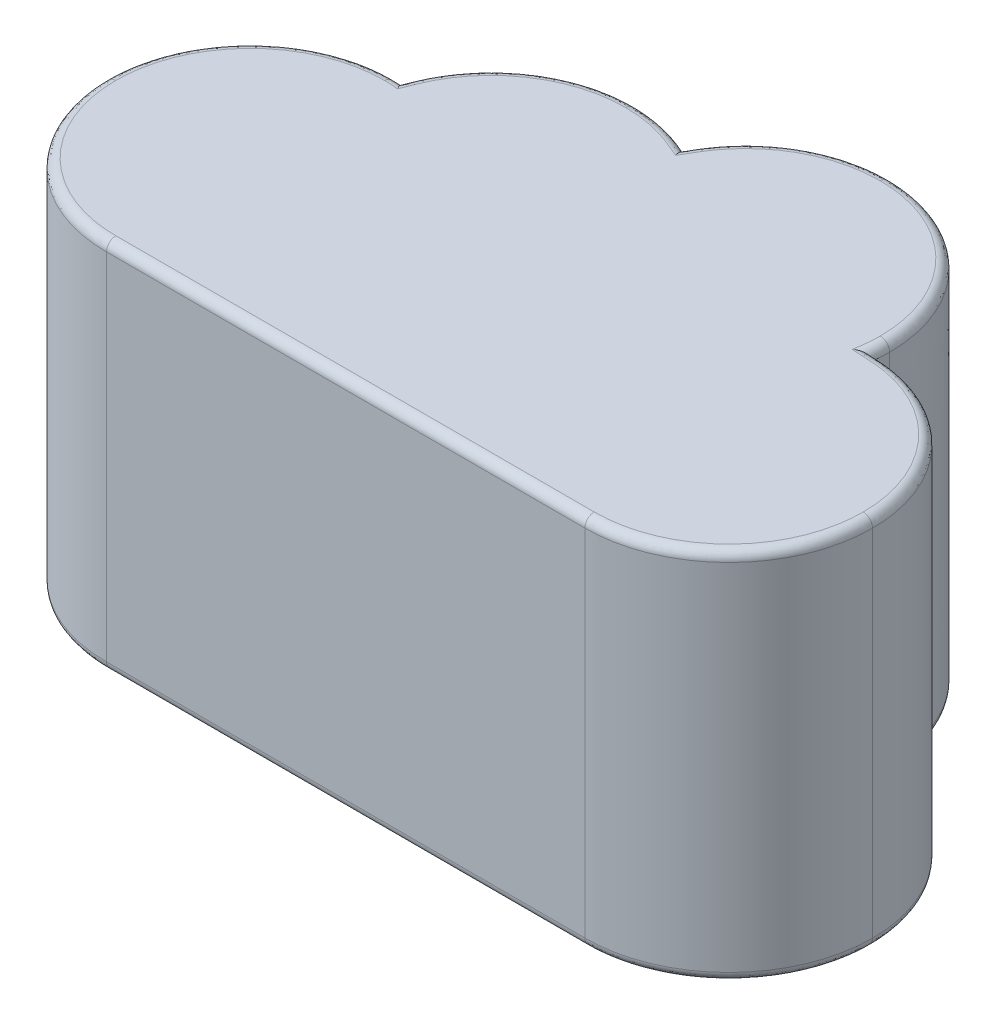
SolidWorks part; units mm, degrees
ref_plane "Front Plane" through (0, 0, 0) normal (0, 0, 1) x (1, 0, 0)
ref_plane "Top Plane" through (0, 0, 0) normal (0, 1, 0) x (1, 0, 0)
ref_plane "Right Plane" through (0, 0, 0) normal (1, 0, 0) x (0, 0, -1)
body saved out of another part "Stock-Wooden Clock Video-1"
fillet "Fillet1" radius 0.5 22 edges
